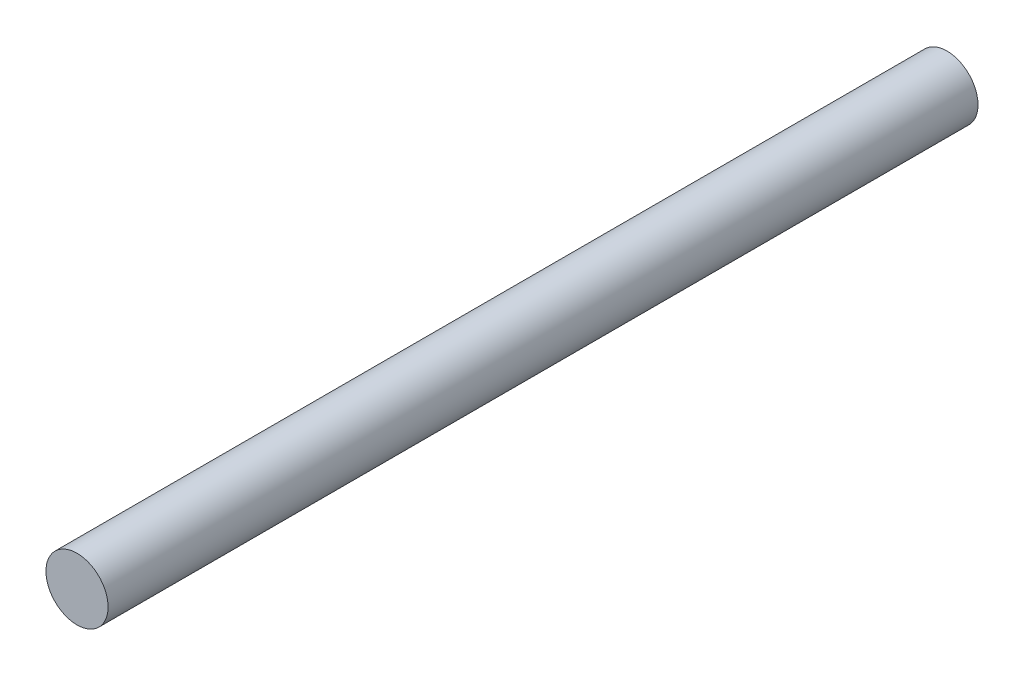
SolidWorks part; units mm, degrees
ref_plane "Front Plane" through (0, 0, 0) normal (0, 0, 1) x (1, 0, 0)
ref_plane "Top Plane" through (0, 0, 0) normal (0, 1, 0) x (1, 0, 0)
ref_plane "Right Plane" through (0, 0, 0) normal (1, 0, 0) x (0, 0, -1)
sketch "Sketch1" plane through (0, 0, 0) normal (0, 0, 1) x (1, 0, 0)
  circle A0 centre (0, 0) radius 5
  dimension "D1" = 10
extrude "Boss-Extrude1" add sketch "Sketch1" along normal mid plane 140
